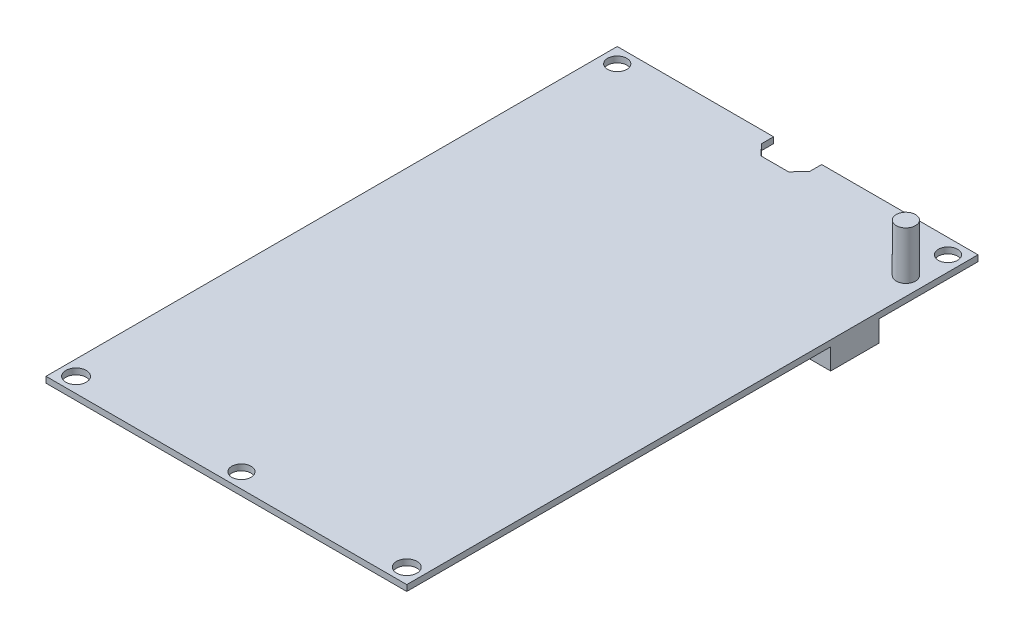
SolidWorks part; units mm, degrees
ref_plane "Front Plane" through (0, 0, 0) normal (0, 0, 1) x (1, 0, 0)
ref_plane "Top Plane" through (0, 0, 0) normal (0, 1, 0) x (1, 0, 0)
ref_plane "Right Plane" through (0, 0, 0) normal (1, 0, 0) x (0, 0, -1)
sketch "Sketch1" plane through (0, 0, 0) normal (0, 1, 0) x (1, 0, 0)
  line L1 (-30, -47.5) -> (30, -47.5)
  line L2 (-30, -47.5) -> (-30, 47.5)
  line L3 (-30, 47.5) -> (30, 47.5)
  line L4 (30, -47.5) -> (30, 47.5)
  line L5 (-30, -47.5) -> (30, 47.5) construction
  line L6 (-30, 47.5) -> (30, -47.5) construction
  point P0 (0, 0)
  dimension "D1" = 60
  dimension "D2" = 95
extrude "Boss-Extrude1" add sketch "Sketch1" along normal blind 1
sketch "Sketch4" plane through (0, 1, 0) normal (0, 1, 0) x (1, 0, 0)
  line L0 (-30, 47.5) -> (-30, -47.5) construction
  line L1 (30, 47.5) -> (-30, 47.5) construction
  line L2 (30, -47.5) -> (30, 47.5) construction
  line L3 (-30, -47.5) -> (30, -47.5) construction
  circle A0 centre (-27.5, 45) radius 1.6
  circle A1 centre (27.5, 45) radius 1.6
  circle A3 centre (0, -45) radius 1.6
  dimension "D1" = 3.2
  dimension "D8" = 3.2
  dimension "D9" = 3.2
  dimension "D2" = 2.5
  dimension "D3" = 2.5
  dimension "D4" = 2.5
  dimension "D5" = 2.5
  dimension "D6" = 2.5
  dimension "D7" = 30
extrude "Cut-Extrude1" cut sketch "Sketch4" against normal through all
sketch "Sketch5" plane through (0, 1, 0) normal (0, 1, 0) x (1, 0, 0)
  line L0 (-4, 47.5) -> (-4, 45.5)
  line L1 (30, 47.5) -> (-30, 47.5) construction
  line L2 (-4, 45.5) -> (-2.3, 43.69)
  line L3 (-2.3, 43.69) -> (2.3, 43.69)
  line L4 (2.3, 43.69) -> (4, 45.5)
  line L5 (4, 45.5) -> (4, 47.5)
  line L6 (4, 47.5) -> (-4, 47.5)
  line L7 (-30, 47.5) -> (-30, -47.5) construction
  point P4 (0, 43.69)
  point P9 (0, 47.5)
  dimension "D1" = 8
  dimension "D2" = 4.6
  dimension "D3" = 3.81
  dimension "D4" = 2
  dimension "D5" = 2
  dimension "D6" = 30
extrude "Cut-Extrude2" cut sketch "Sketch5" against normal through all
sketch "Sketch6" plane through (0, 1, 0) normal (0, 1, 0) x (1, 0, 0)
  line L0 (-30, 47.5) -> (-30, -47.5) construction
  line L1 (-30, -47.5) -> (30, -47.5) construction
  line L2 (30, -47.5) -> (30, 47.5) construction
  circle A0 centre (-27.5, -45) radius 1.7
  circle A1 centre (27.5, -45) radius 1.7
  dimension "D1" = 3.4
  dimension "D4" = 3.4
  dimension "D2" = 2.5
  dimension "D3" = 2.5
  dimension "D5" = 2.5
  dimension "D6" = 2.5
extrude "Cut-Extrude3" cut sketch "Sketch6" against normal blind 1
sketch "Sketch7" plane through (0, 0, 0) normal (0, -1, 0) x (1, 0, 0)
  line L0 (30, 47.5) -> (30, -47.5) construction
  line L1 (30, -23) -> (23, -23)
  line L2 (30, -23) -> (30, -31)
  line L3 (30, -31) -> (23, -31)
  line L4 (23, -23) -> (23, -31)
  line L5 (30, -47.5) -> (4, -47.5) construction
  dimension "D1" = 16.5
  dimension "D2" = 24.5
  dimension "D3" = 7
extrude "Boss-Extrude2" add sketch "Sketch7" along normal blind 3.5
sketch "Sketch8" plane through (0, 1, 0) normal (0, 1, 0) x (1, 0, 0)
  line L0 (30, -47.5) -> (30, 47.5) construction
  line L1 (30, 47.5) -> (4, 47.5) construction
  circle A0 centre (27, 38.5) radius 1.6
  dimension "D1" = 3.2
  dimension "D2" = 3
  dimension "D3" = 9
extrude "Boss-Extrude3" add sketch "Sketch8" along normal blind 8
sketch "Sketch9" plane through (0, 0, 0) normal (0, -1, 0) x (1, 0, 0)
  line L0 (30, -47.5) -> (4, -47.5) construction
  line L1 (15, -47.5) -> (5.5, -47.5)
  line L2 (15, -47.5) -> (15, -44)
  line L3 (15, -44) -> (5.5, -44)
  line L4 (5.5, -47.5) -> (5.5, -44)
  line L5 (30, -31) -> (30, -47.5) construction
  dimension "D1" = 9.5
  dimension "D2" = 3.5
  dimension "D3" = 15
extrude "Boss-Extrude4" add sketch "Sketch9" along normal blind 2.5
